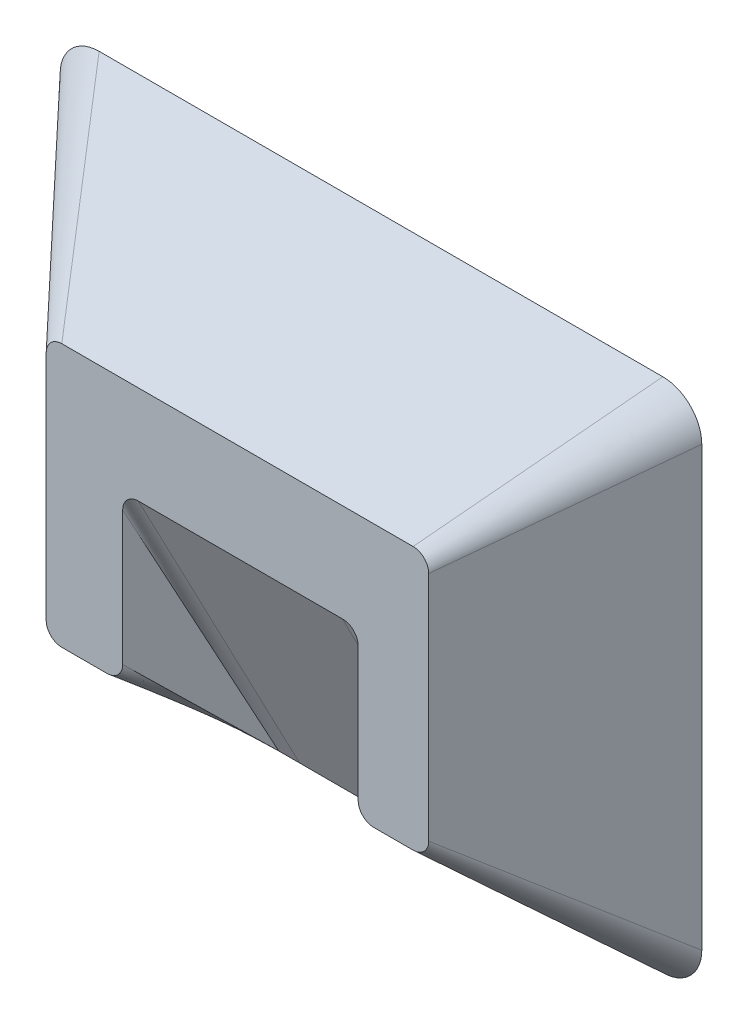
SolidWorks part; units mm, degrees
ref_plane "Front" through (0, 0, 0) normal (0, 0, 1) x (1, 0, 0)
ref_plane "Top" through (0, 0, 0) normal (0, 1, 0) x (1, 0, 0)
ref_plane "Right" through (0, 0, 0) normal (1, 0, 0) x (0, 0, -1)
ref_plane "Plane1" through (0, 0, 25.4) normal (0, 0, 1) x (1, 0, 0)
sketch "Sketch2" plane through (0, 0, 25.4) normal (0, 0, 1) x (1, 0, 0)
  line L0 (85.3975, 24.8923) -> (85.3975, 62.6175)
  line L1 (82.8575, 65.1575) -> (25.6753, 65.1575)
  line L2 (23.1353, 62.6175) -> (23.1353, 24.8923)
  line L3 (25.6753, 22.3523) -> (33.0477, 22.3523)
  line L4 (35.5877, 24.8923) -> (35.5877, 46.6628)
  line L5 (38.1277, 49.2028) -> (71.3779, 49.2028)
  line L6 (73.9179, 46.6628) -> (73.9179, 24.8923)
  line L7 (76.4579, 22.3523) -> (82.8575, 22.3523)
  arc A0 (85.3975, 24.8923) -> (82.8575, 22.3523) centre (82.8575, 24.8923) cw
  arc A1 (85.3975, 62.6175) -> (82.8575, 65.1575) centre (82.8575, 62.6175) ccw
  arc A2 (25.6753, 65.1575) -> (23.1353, 62.6175) centre (25.6753, 62.6175) ccw
  arc A3 (23.1353, 24.8923) -> (25.6753, 22.3523) centre (25.6753, 24.8923) ccw
  arc A4 (33.0477, 22.3523) -> (35.5877, 24.8923) centre (33.0477, 24.8923) ccw
  arc A5 (35.5877, 46.6628) -> (38.1277, 49.2028) centre (38.1277, 46.6628) cw
  arc A6 (71.3779, 49.2028) -> (73.9179, 46.6628) centre (71.3779, 46.6628) cw
  arc A7 (73.9179, 24.8923) -> (76.4579, 22.3523) centre (76.4579, 24.8923) ccw
  dimension "D1" = 2.54
sketch "Sketch1" plane through (0, 0, 0) normal (0, 0, 1) x (1, 0, 0)
  line L0 (35.5877, 0) -> (73.9179, 0)
  line L1 (6.35, 0) -> (35.5877, 0)
  line L2 (0, 6.35) -> (0, 77.6575)
  line L3 (6.35, 84.0075) -> (98.0968, 84.0075)
  line L4 (104.4468, 6.35) -> (104.4468, 77.6575)
  line L6 (73.9179, 0) -> (98.0968, 0)
  arc A0 (0, 77.6575) -> (6.35, 84.0075) centre (6.35, 77.6575) cw
  arc A1 (6.35, 0) -> (0, 6.35) centre (6.35, 6.35) cw
  arc A2 (98.0968, 0) -> (104.4468, 6.35) centre (98.0968, 6.35) ccw
  arc A3 (98.0968, 84.0075) -> (104.4468, 77.6575) centre (98.0968, 77.6575) cw
  point P8 (0, 0)
  dimension "D1" = 6.35
sketch3d "3DSketch1"
  line L0 (35.5877, 0, 0) -> (35.5877, 24.8923, 25.4)
sketch3d "3DSketch2"
  line L0 (73.9179, 0, 0) -> (73.9179, 24.8923, 25.4)
sketch3d "3DSketch3"
  line L0 (35.5877, 46.6628, 25.4) -> (35.5877, 0, 0)
sketch3d "3DSketch4"
  line L0 (73.9179, 46.6628, 25.4) -> (73.9179, 0, 0)
sketch3d "3DSketch5"
  line L0 (82.8575, 22.3523, 25.4) -> (98.0968, 0, 0)
sketch3d "3DSketch6"
  line L0 (85.3975, 24.8923, 25.4) -> (104.4468, 6.35, 0)
sketch3d "3DSketch7"
  line L0 (85.3975, 62.6175, 25.4) -> (104.4468, 77.6575, 0)
sketch3d "3DSketch8"
  line L0 (82.8575, 65.1575, 25.4) -> (98.0968, 84.0075, 0)
sketch3d "3DSketch10"
  line L0 (23.1353, 62.6175, 25.4) -> (0, 77.6575, 0)
sketch3d "3DSketch11"
  line L0 (6.35, 0, 0) -> (25.6753, 22.3523, 25.4)
sketch3d "3DSketch12"
  line L0 (0, 6.35, 0) -> (23.1353, 24.8923, 25.4)
sketch3d "3DSketch13"
  line L0 (6.35, 84.0075, 0) -> (25.6753, 65.1575, 25.4)
loft "Loft1" add profiles "Sketch1", "Sketch2"
